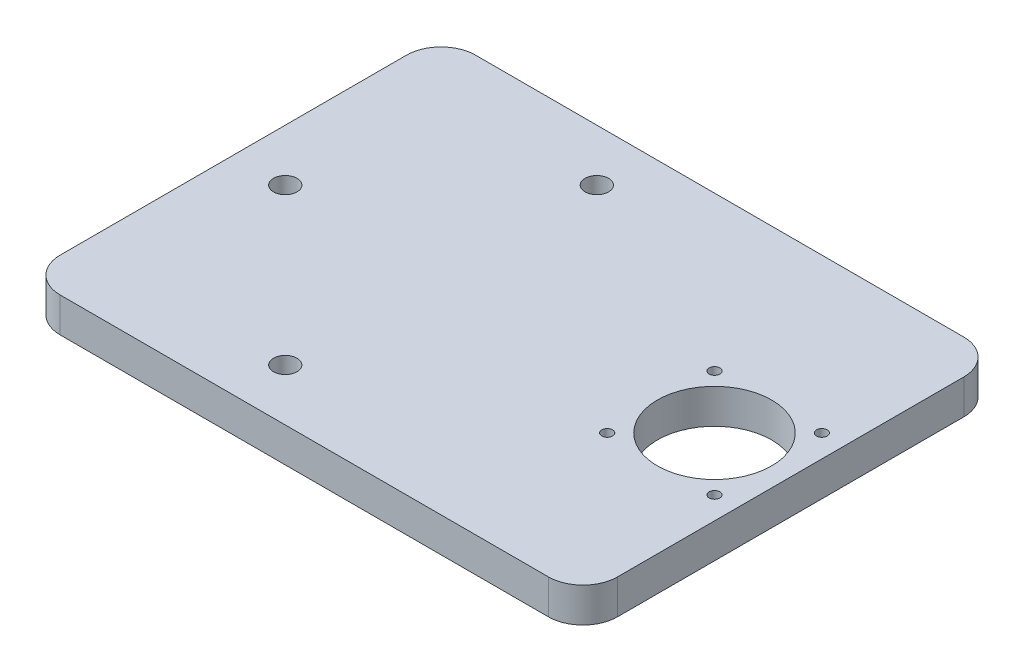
SolidWorks part; units mm, degrees
ref_plane "前视基准面" through (0, 0, 0) normal (0, 0, 1) x (1, 0, 0)
ref_plane "上视基准面" through (0, 0, 0) normal (0, 1, 0) x (1, 0, 0)
ref_plane "右视基准面" through (0, 0, 0) normal (1, 0, 0) x (0, 0, -1)
other "Configuration Table"
sketch "草图1" plane through (0, 0, 0) normal (0, 1, 0) x (1, 0, 0)
  line L1 (-80.5, -60) -> (80.5, -60)
  line L2 (-80.5, -60) -> (-80.5, 60)
  line L3 (-80.5, 60) -> (80.5, 60)
  line L4 (80.5, -60) -> (80.5, 60)
  line L5 (-80.5, -60) -> (80.5, 60) construction
  line L6 (-80.5, 60) -> (80.5, -60) construction
  point P0 (0, 0)
  dimension "D1" = 161
  dimension "D2" = 120
extrude "凸台-拉伸1" add sketch "草图1" along normal blind 10
fillet "圆角1" radius 10 4 edges at (80.5, 5, 60) (80.5, 5, -60) (-80.5, 5, -60) (-80.5, 5, 60)
sketch "草图2" plane through (0, 10, 0) normal (0, 1, 0) x (1, 0, 0)
  circle A0 centre (74, 15.5) radius 1.55
  circle A1 centre (74, -15.5) radius 1.55
  circle A2 centre (43, 15.5) radius 1.55
  circle A3 centre (43, -15.5) radius 1.55
  dimension "D1" = 3.1
  dimension "D2" = 3.1
  dimension "D3" = 3.1
  dimension "D4" = 3.1
extrude "切除-拉伸1" cut sketch "草图2" against normal blind 10
sketch "草图3" plane through (0, 0, 0) normal (0, -1, 0) x (1, 0, 0)
  circle A0 centre (58.5, 0) radius 16.5
  dimension "D1" = 33
extrude "切除-拉伸2" cut sketch "草图3" against normal blind 10
sketch "草图4" plane through (0, 0, 0) normal (0, -1, 0) x (1, 0, 0)
  line L0 (-70.5, 60) -> (70.5, 60) construction
  line L1 (-80.5, -50) -> (-80.5, 50) construction
  line L2 (70.5, -60) -> (-70.5, -60) construction
  circle A0 centre (-20.5, 45) radius 3.4
  circle A1 centre (-65.5, 0) radius 3.4
  circle A2 centre (-20.5, -45) radius 3.4
  dimension "D1" = 6.8
  dimension "D2" = 6.8
  dimension "D3" = 6.8
  dimension "D4" = 15
  dimension "D5" = 15
  dimension "D6" = 15
extrude "切除-拉伸3" cut sketch "草图4" against normal through all
